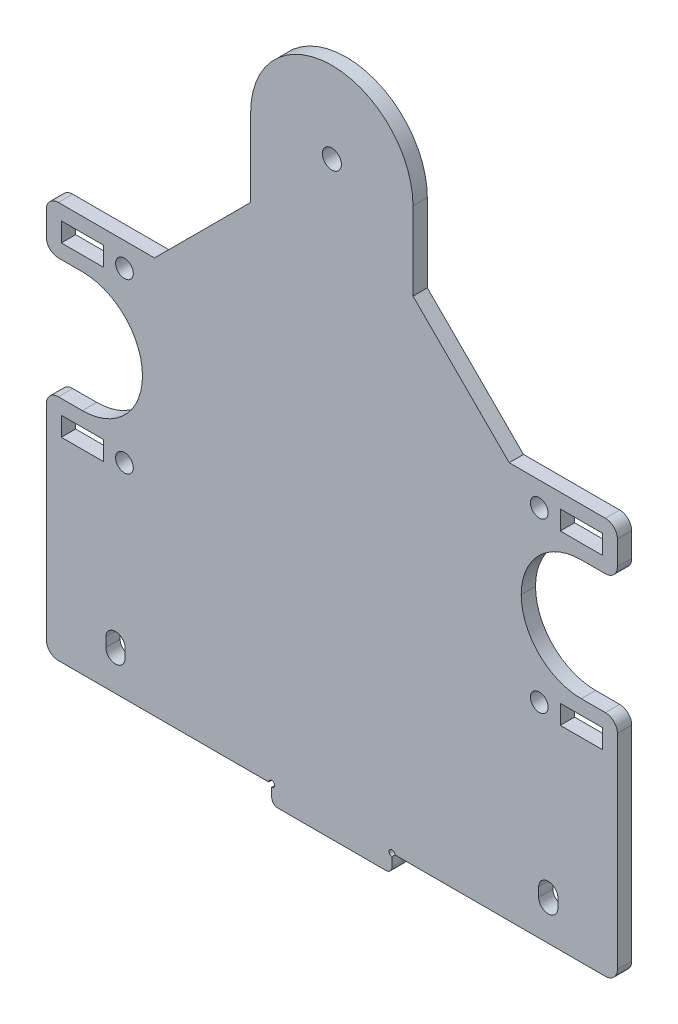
SolidWorks part; units mm, degrees
ref_plane "Front Plane" through (0, 0, 0) normal (0, 0, 1) x (1, 0, 0)
ref_plane "Top Plane" through (0, 0, 0) normal (0, 1, 0) x (1, 0, 0)
ref_plane "Right Plane" through (0, 0, 0) normal (1, 0, 0) x (0, 0, -1)
sketch "Sketch1"
sketch_block_instance "pulley_block-1"
sketch_block "pulley_block"
sketch "Sketch2" plane through (0, 0, 0) normal (0, 0, 1) x (1, 0, 0)
  line L0 (-13.5, 0) -> (-13.5, -29) construction
  line L1 (13.5, 0) -> (13.5, -29) construction
  line L2 (13.5, -29) -> (47.5, -29) construction
  line L3 (47.5, -29) -> (47.5, -37) construction
  line L4 (47.5, -37) -> (31.5, -37) construction
  line L5 (31.5, -37) -> (31.5, -57) construction
  line L6 (31.5, -57) -> (47.5, -57) construction
  line L7 (47.5, -57) -> (47.5, -65) construction
  line L8 (47.5, -65) -> (18.6, -65) construction
  line L9 (18.6, -65) -> (18.6, -79) construction
  line L10 (18.6, -79) -> (6.6, -79) construction
  line L11 (6.6, -79) -> (6.6, -43.815) construction
  line L12 (-6.6, -43.815) -> (6.6, -43.815) construction
  line L13 (-6.6, -79) -> (-6.6, -43.815) construction
  line L14 (-18.6, -79) -> (-6.6, -79) construction
  line L15 (-18.6, -65) -> (-18.6, -79) construction
  line L16 (-47.5, -65) -> (-18.6, -65) construction
  line L17 (-47.5, -57) -> (-47.5, -65) construction
  line L18 (-31.5, -57) -> (-47.5, -57) construction
  line L19 (-31.5, -37) -> (-31.5, -57) construction
  line L20 (-47.5, -37) -> (-31.5, -37) construction
  line L21 (-47.5, -29) -> (-47.5, -37) construction
  line L22 (-13.5, -29) -> (-47.5, -29) construction
  line L23 (-13.5, 0) -> (-13.5, -29)
  line L24 (13.5, 0) -> (13.5, -29)
  line L25 (13.5, -29) -> (47.5, -29)
  line L26 (47.5, -29) -> (47.5, -37)
  line L27 (47.5, -37) -> (31.5, -37)
  line L28 (31.5, -37) -> (31.5, -57)
  line L29 (31.5, -57) -> (47.5, -57)
  line L30 (47.5, -57) -> (47.5, -65)
  line L31 (47.5, -65) -> (18.6, -65)
  line L32 (18.6, -65) -> (18.6, -79)
  line L33 (18.6, -79) -> (6.6, -79)
  line L34 (6.6, -79) -> (6.6, -43.815)
  line L35 (-6.6, -43.815) -> (6.6, -43.815)
  line L36 (-6.6, -79) -> (-6.6, -43.815)
  line L37 (-18.6, -79) -> (-6.6, -79)
  line L38 (-18.6, -65) -> (-18.6, -79)
  line L39 (-47.5, -65) -> (-18.6, -65)
  line L40 (-47.5, -57) -> (-47.5, -65)
  line L41 (-31.5, -57) -> (-47.5, -57)
  line L42 (-31.5, -37) -> (-31.5, -57)
  line L43 (-47.5, -37) -> (-31.5, -37)
  line L44 (-47.5, -29) -> (-47.5, -37)
  line L45 (-13.5, -29) -> (-47.5, -29)
  line L46 (-38, -59.4125) -> (-38, -62.5875) construction
  line L47 (-45, -62.5875) -> (-38, -62.5875) construction
  line L48 (-45, -59.4125) -> (-45, -62.5875) construction
  line L49 (-45, -59.4125) -> (-38, -59.4125) construction
  line L50 (38, -59.4125) -> (38, -62.5875) construction
  line L51 (45, -62.5875) -> (38, -62.5875) construction
  line L52 (45, -59.4125) -> (38, -59.4125) construction
  line L53 (45, -59.4125) -> (45, -62.5875) construction
  line L54 (45, -34.5875) -> (45, -31.4125) construction
  line L55 (45, -34.5875) -> (38, -34.5875) construction
  line L56 (38, -34.5875) -> (38, -31.4125) construction
  line L57 (45, -31.4125) -> (38, -31.4125) construction
  line L58 (-38, -34.5875) -> (-38, -31.4125) construction
  line L59 (-45, -34.5875) -> (-38, -34.5875) construction
  line L60 (-45, -34.5875) -> (-45, -31.4125) construction
  line L61 (-45, -31.4125) -> (-38, -31.4125) construction
  line L62 (-38, -59.4125) -> (-38, -62.5875)
  line L63 (-45, -62.5875) -> (-38, -62.5875)
  line L64 (-45, -59.4125) -> (-45, -62.5875)
  line L65 (-45, -59.4125) -> (-38, -59.4125)
  line L66 (38, -59.4125) -> (38, -62.5875)
  line L67 (45, -62.5875) -> (38, -62.5875)
  line L68 (45, -59.4125) -> (38, -59.4125)
  line L69 (45, -59.4125) -> (45, -62.5875)
  line L70 (45, -34.5875) -> (45, -31.4125)
  line L71 (45, -34.5875) -> (38, -34.5875)
  line L72 (38, -34.5875) -> (38, -31.4125)
  line L73 (45, -31.4125) -> (38, -31.4125)
  line L74 (-38, -34.5875) -> (-38, -31.4125)
  line L75 (-45, -34.5875) -> (-38, -34.5875)
  line L76 (-45, -34.5875) -> (-45, -31.4125)
  line L77 (-45, -31.4125) -> (-38, -31.4125)
  arc A0 (13.5, 0) -> (-13.5, 0) centre (0, 0) ccw construction
  arc A1 (13.5, 0) -> (-13.5, 0) centre (0, 0) ccw
  circle A4 centre (-34.5, -33) radius 1.4732 construction
  circle A5 centre (-34.5, -61) radius 1.4732 construction
  circle A6 centre (0, 0) radius 1.5875 construction
  circle A7 centre (34.5, -61) radius 1.4732 construction
  circle A8 centre (0, 0) radius 1.5875
  circle A10 centre (34.5, -33) radius 1.4732 construction
  circle A12 centre (-34.5, -61) radius 1.4732
  circle A14 centre (34.5, -61) radius 1.4732
  circle A17 centre (34.5, -33) radius 1.4732
  circle A18 centre (-34.5, -33) radius 1.4732
extrude "Boss-Extrude1" add sketch "Sketch2" along normal blind 2.3813
chamfer "Chamfer1" distance 16 angle 45 2 edges at (13.5, -29, 1.1906) (-13.5, -29, 1.1906)
fillet "Fillet1" [suppressed] radius 2
fillet "Fillet6" [suppressed] radius 4
fillet "Fillet5" radius 10 4 edges at (-31.5, -37, 1.1906) (-31.5, -57, 1.1906) (31.5, -57, 1.1906) (31.5, -37, 1.1906)
sketch "Sketch4" plane through (0, 0, 0) normal (0, 0, -1) x (-1, 0, 0)
  line L0 (12.2, -75.5) -> (13.7, -75.5) construction
  line L1 (12.2, -73.9) -> (13.7, -73.9)
  line L2 (12.2, -77.1) -> (13.7, -77.1)
  line L3 (0, 0) -> (0, -79.8224) construction
  line L4 (6.35, -80.6293) -> (6.35, -56.0354) construction
  line L5 (18.6, -79) -> (6.6, -79) construction
  line L6 (12.2, -67.5) -> (13.7, -67.5) construction
  line L7 (12.2, -65.9) -> (13.7, -65.9)
  line L8 (12.2, -69.1) -> (13.7, -69.1)
  line L9 (12.95, -67.5) -> (12.95, -75.5) construction
  line L10 (-12.2, -75.5) -> (-13.7, -75.5) construction
  line L11 (-12.2, -73.9) -> (-13.7, -73.9)
  line L12 (-12.2, -77.1) -> (-13.7, -77.1)
  line L13 (-12.2, -67.5) -> (-13.7, -67.5) construction
  line L14 (-12.2, -65.9) -> (-13.7, -65.9)
  line L15 (-12.2, -69.1) -> (-13.7, -69.1)
  arc A0 (12.2, -73.9) -> (12.2, -77.1) centre (12.2, -75.5) ccw
  arc A1 (13.7, -77.1) -> (13.7, -73.9) centre (13.7, -75.5) ccw
  arc A2 (12.2, -65.9) -> (12.2, -69.1) centre (12.2, -67.5) ccw
  arc A3 (13.7, -69.1) -> (13.7, -65.9) centre (13.7, -67.5) ccw
  arc A4 (-12.2, -73.9) -> (-12.2, -77.1) centre (-12.2, -75.5) cw
  arc A5 (-13.7, -77.1) -> (-13.7, -73.9) centre (-13.7, -75.5) cw
  arc A6 (-12.2, -65.9) -> (-12.2, -69.1) centre (-12.2, -67.5) cw
  arc A7 (-13.7, -69.1) -> (-13.7, -65.9) centre (-13.7, -67.5) cw
  point P2 (12.95, -75.5)
  point P16 (12.95, -67.5)
  point P25 (-12.95, -75.5)
  point P32 (-12.95, -67.5)
  dimension "D1" = 1.6
  dimension "D2" = 1.5
  dimension "D3" = 6.35
  dimension "D4" = 6.6
  dimension "D5" = 3.5
  dimension "D6" = 8
extrude "Cut-Extrude2" [suppressed] cut sketch "Sketch4" against normal up to next
fillet "Fillet3" [suppressed] radius 3
sketch "Sketch5" plane through (0, 0, 0) normal (0, 0, -1) x (-1, 0, 0)
  line L0 (-47.5, -65) -> (-47.5, -95)
  line L1 (-47.5, -95) -> (47.5, -95)
  line L2 (47.5, -95) -> (47.5, -65)
  line L3 (-18.6, -65) -> (-47.5, -65) construction
  line L4 (-18.6, -79) -> (-18.6, -65) construction
  line L5 (-6.6, -79) -> (-18.6, -79) construction
  line L6 (-6.6, -43.815) -> (-6.6, -79) construction
  line L7 (6.6, -43.815) -> (-6.6, -43.815) construction
  line L8 (6.6, -79) -> (6.6, -43.815) construction
  line L9 (18.6, -79) -> (6.6, -79) construction
  line L10 (18.6, -65) -> (18.6, -79) construction
  line L11 (47.5, -65) -> (18.6, -65) construction
  line L12 (-18.6, -65) -> (-47.5, -65)
  line L13 (-18.6, -79) -> (-18.6, -65)
  line L14 (-6.6, -79) -> (-18.6, -79)
  line L15 (-6.6, -43.815) -> (-6.6, -79)
  line L16 (6.6, -43.815) -> (-6.6, -43.815)
  line L17 (6.6, -79) -> (6.6, -43.815)
  line L18 (18.6, -79) -> (6.6, -79)
  line L19 (18.6, -65) -> (18.6, -79)
  line L20 (47.5, -65) -> (18.6, -65)
  dimension "D1" = 30
extrude "Boss-Extrude2" add sketch "Sketch5" against normal up to surface (2.3813 mm away)
fillet "Fillet2" radius 2 8 edges at (47.5, -95, 1.1906) (-47.5, -95, 1.1906) (-47.5, -57, 1.1906) (-47.5, -37, 1.1906) (-47.5, -29, 1.1906) (47.5, -57, 1.1906) (47.5, -37, 1.1906) (47.5, -29, 1.1906)
sketch "Sketch6" plane through (0, 0, 0) normal (0, 0, -1) x (-1, 0, 0)
  line L0 (36, -89.15) -> (36, -87.65) construction
  line L1 (34.4, -89.15) -> (34.4, -87.65)
  line L2 (37.6, -89.15) -> (37.6, -87.65)
  line L3 (-45.5, -95) -> (45.5, -95) construction
  line L4 (0, -95) -> (0, -78.3578) construction
  line L5 (-36, -89.15) -> (-36, -87.65) construction
  line L6 (-34.4, -89.15) -> (-34.4, -87.65)
  line L7 (-37.6, -89.15) -> (-37.6, -87.65)
  arc A0 (34.4, -89.15) -> (37.6, -89.15) centre (36, -89.15) ccw
  arc A1 (37.6, -87.65) -> (34.4, -87.65) centre (36, -87.65) ccw
  arc A2 (-34.4, -89.15) -> (-37.6, -89.15) centre (-36, -89.15) cw
  arc A3 (-37.6, -87.65) -> (-34.4, -87.65) centre (-36, -87.65) cw
  point P2 (36, -88.4)
  point P14 (-36, -88.4)
  dimension "D1" = 1.6
  dimension "D2" = 1.5
  dimension "D3" = 6.6
  dimension "D4" = 36
extrude "Cut-Extrude3" cut sketch "Sketch6" against normal through all
sketch "Sketch7" plane through (0, 0, 0) normal (0, 0, -1) x (-1, 0, 0)
  line L0 (-45.5, -95) -> (45.5, -95) construction
  line L1 (10, -95) -> (-10, -95)
  line L2 (10, -95) -> (10, -98)
  line L3 (10, -98) -> (-10, -98)
  line L4 (-10, -95) -> (-10, -98)
  line L5 (0, -95) -> (0, -82.4657) construction
  point P9 (0, -95)
  dimension "D1" = 3
  dimension "D2" = 20
extrude "Boss-Extrude3" add sketch "Sketch7" against normal up to surface (2.3813 mm away)
fillet "Fillet4" radius 1 2 edges at (-10, -98, 1.1906) (10, -98, 1.1906)
sketch "Sketch8" plane through (0, 0, 0) normal (0, 0, -1) x (-1, 0, 0)
  circle A0 centre (-10, -95) radius 0.5
  circle A1 centre (10, -95) radius 0.5
  dimension "D1" = 1
extrude "Cut-Extrude4" cut sketch "Sketch8" against normal up to next
other "Move Face2" [suppressed] parameters "D1"=0.0762
other "Move Face3" [suppressed] parameters "D1"=0.0762
equation "\"D9@pulley_block\"=\"D7@pulley_block\"/2"
equation "\"D22@pulley_block\"=\"D3@pulley_block\""
equation "\"D12@pulley_block\"=\"D1@pulley_block\""
equation "\"D25@pulley_block\"=-\"D21@pulley_block\""
equation "\"relief_hole_diameter\"=1"
equation "\"plate_thickness\"=3.175"
equation "\"D6@Sketch1\"=\"plate_thickness\""
equation "\"D1@Sketch1\"=4 * \"plate_thickness\" + .5"
